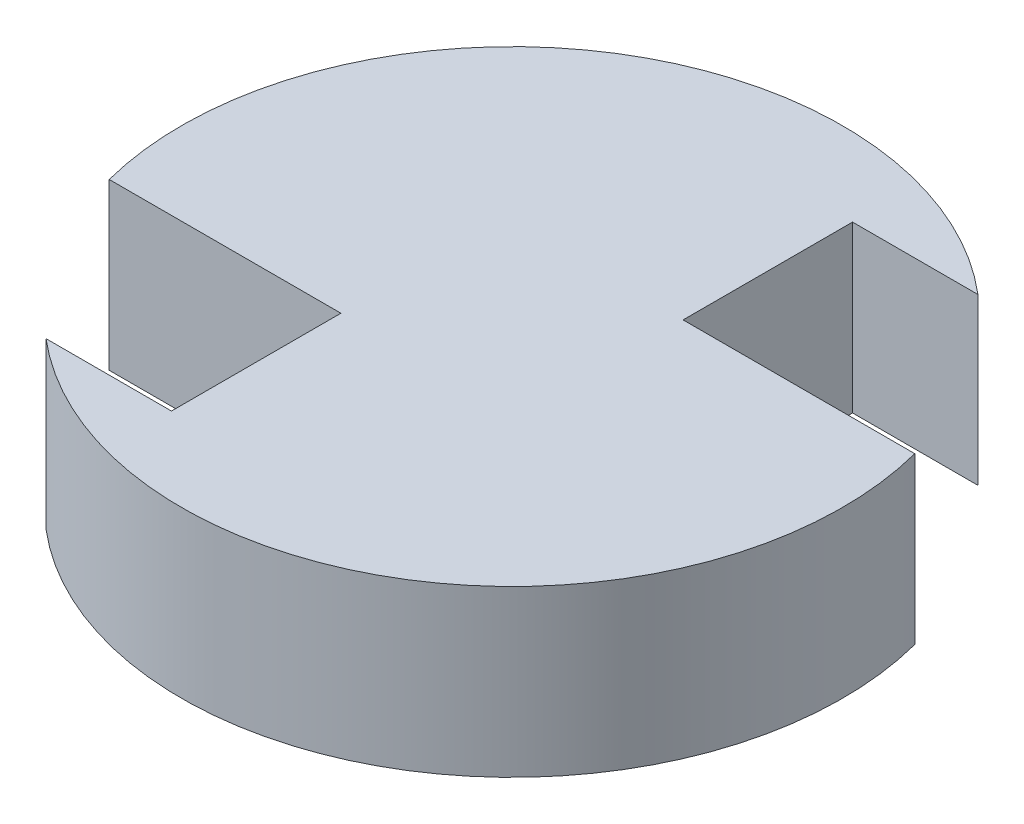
SolidWorks part; units mm, degrees
ref_plane "Alzado" through (0, 0, 0) normal (0, 0, 1) x (1, 0, 0)
ref_plane "Planta" through (0, 0, 0) normal (0, 1, 0) x (1, 0, 0)
ref_plane "Vista lateral" through (0, 0, 0) normal (1, 0, 0) x (0, 0, -1)
sketch "Croquis1" plane through (0, 0, 0) normal (0, 1, 0) x (1, 0, 0)
  line L0 (8, 0) -> (8, 2)
  line L1 (0, 28.7477) -> (-11.475, 8.8724)
  line L2 (-25, -14.5536) -> (-2.05, -14.5536)
  line L3 (25, -14.5536) -> (13.525, 5.3217)
  line L4 (7.746, 2) -> (2.14, 2)
  line L5 (2.14, 2) -> (2.14, 6.1)
  line L6 (2.14, 6.1) -> (5.1759, 6.1)
  line L7 (0, 0) -> (0, 5.2465) construction
  line L8 (0, 0) -> (-5.446, 0) construction
  line L9 (-8, -2) -> (-8, 2)
  line L10 (12.5541, 7.1282) -> (8.9994, 5.0759) construction
  line L11 (10.0244, 3.3006) -> (7.9744, 6.8513)
  line L12 (10.0244, 3.3006) -> (13.525, 5.3217)
  line L13 (-2.14, -6.1) -> (-5.1759, -6.1)
  line L14 (-2.14, -2) -> (-2.14, -6.1)
  line L15 (-7.746, -2) -> (-2.14, -2)
  line L16 (7.9744, 6.8513) -> (11.475, 8.8724)
  line L17 (11.475, 8.8724) -> (0, 28.7477)
  line L18 (-10.0244, 3.3006) -> (-7.9744, 6.8513)
  line L19 (-10.0244, 3.3006) -> (-13.525, 5.3217)
  line L20 (-7.9744, 6.8513) -> (-11.475, 8.8724)
  line L21 (-25, -14.5536) -> (-14.5217, -8.504) construction
  line L22 (-2.05, -10.5115) -> (-2.05, -14.5536)
  line L23 (-2.05, -10.5115) -> (2.05, -10.5115)
  line L24 (2.05, -10.5115) -> (2.05, -14.5536)
  line L25 (-13.525, 5.3217) -> (-25, -14.5536)
  line L26 (2.05, -14.5536) -> (25, -14.5536)
  arc A1 (-5.1759, -6.1) -> (7.746, 2) centre (0, 0) ccw
  arc A2 (5.1759, 6.1) -> (-7.746, -2) centre (0, 0) ccw
  point P5 (0, 0)
  point P23 (-8, 0)
  point P37 (-13.1269, -13.3008)
  point P38 (25.5287, -14.2702)
  dimension "D2" = 22.95
  dimension "D1" = 22.95
  dimension "D3" = 22.95
  dimension "D4" = 90
  dimension "D5" = 4.1
  dimension "D6" = 22.95
  dimension "D7" = 22.95
extrude "Saliente-Extruir2" add sketch "Croquis1" along normal blind 4 contours L6 A2 L15 L14 L13 A1 L4 L5
